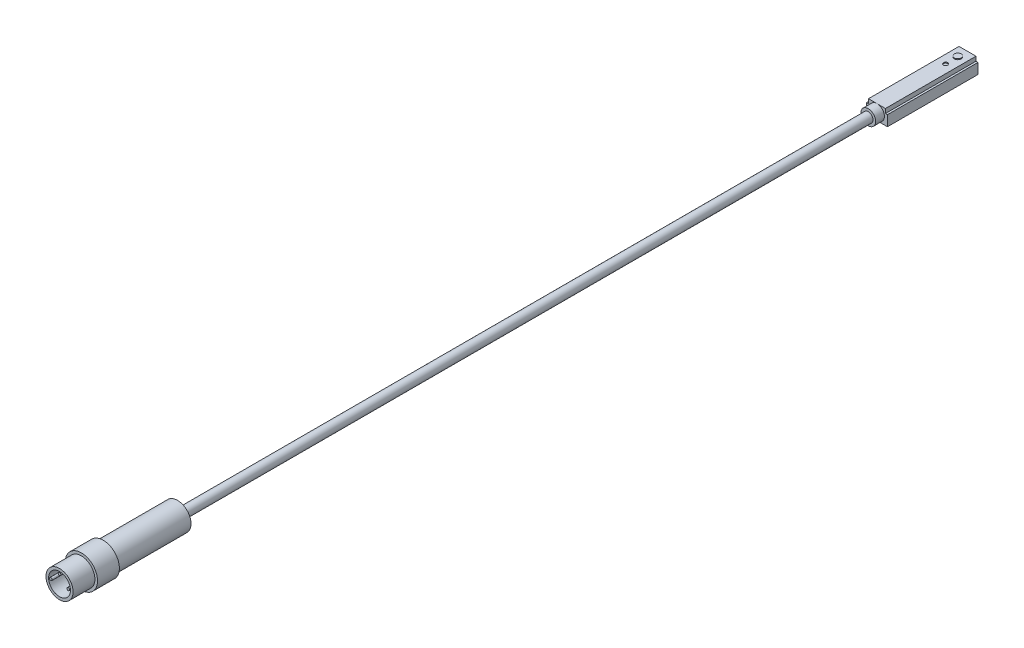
SolidWorks part; units mm, degrees
ref_plane "Front Plane" through (0, 0, 0) normal (0, 0, 1) x (1, 0, 0)
ref_plane "Top Plane" through (0, 0, 0) normal (0, 1, 0) x (1, 0, 0)
ref_plane "Right Plane" through (0, 0, 0) normal (1, 0, 0) x (0, 0, -1)
sketch "S2D0001" plane through (0, 0, 0) normal (0, 0, 1) x (1, 0, 0)
  line L0 (-3.048, 0) -> (-3.048, 3.048)
  line L1 (-2.4638, 4.318) -> (2.4638, 4.318)
  line L2 (3.048, 3.048) -> (3.048, 0)
  line L3 (3.048, 0) -> (-3.048, 0)
  line L4 (2.4638, 4.318) -> (2.4638, 3.048)
  line L5 (2.4638, 3.048) -> (3.048, 3.048)
  line L6 (-2.4638, 4.318) -> (-2.4638, 3.048)
  line L7 (-2.4638, 3.048) -> (-3.048, 3.048)
  line L8 (0, 0) -> (0, 4.5339) construction
  dimension "D1" = 4.318
  dimension "D2" = 6.096
  dimension "D3" = 4.9276
  dimension "D4" = 1.27
extrude "Extrude1" add sketch "S2D0001" along normal blind 28.8544
sketch "Sketch2" plane through (0, 0, 28.8544) normal (0, 0, 1) x (1, 0, 0)
  line L0 (-3.048, 0) -> (3.048, 0) construction
  circle A0 centre (0, 2.159) radius 2.159
  dimension "D1" = 4.318
  dimension "D2" = 2.159
extrude "Cut-Extrude1" cut sketch "Sketch2" against normal blind 2.54 flip side to cut
ref_plane "Plane2" through (0, 0, 0) normal (1, 0, 0) x (0, 1, 0)
sketch "Sketch3" plane through (0, 0, 0) normal (1, 0, 0) x (0, 1, 0)
  line L0 (-0.508, 2.8224) -> (4.572, 2.8224)
  line L1 (4.572, 2.8224) -> (4.572, 3.8384)
  line L2 (4.572, 3.8384) -> (-0.508, 3.8384)
  line L3 (-0.508, 3.8384) -> (-0.508, 2.8224)
  line L4 (-0.762, 2.8224) -> (4.826, 2.8224) construction
  line L5 (0, 0) -> (3.048, 0) construction
  line L8 (0, 26.3144) -> (0, 0) construction
  line L9 (4.318, 26.3144) -> (4.318, 0) construction
  dimension "D1" = 2.8224
  dimension "D2" = 0.254
  dimension "D3" = 0.508
  dimension "D4" = 2.032
revolve "Revolve1" add sketch "Sketch3" angle 360 about L4
sketch "Sketch4" plane through (0, 0, 0) normal (0, 0, -1) x (-1, 0, 0)
  circle A0 centre (0, 2.159) radius 1.397
  circle A1 centre (0, 2.159) radius 2.159 construction
  dimension "D1" = 2.794
extrude "Extrude2" add sketch "Sketch4" against normal blind 263.906
ref_plane "Plane4" through (0, 0, 0) normal (1, 0, 0) x (0, 0, -1)
sketch "Sketch5" plane through (0, 0, 0) normal (1, 0, 0) x (0, 0, -1)
  line L0 (-263.906, 2.159) -> (-263.906, 6.096)
  line L1 (-263.906, 6.096) -> (-257.556, 6.096)
  line L2 (-257.556, 6.096) -> (-257.556, 6.858)
  line L3 (-257.556, 6.858) -> (-251.206, 6.858)
  line L4 (-251.206, 6.858) -> (-251.206, 6.096)
  line L5 (-251.206, 6.096) -> (-229.616, 6.096)
  line L6 (-229.616, 6.096) -> (-229.616, 2.159)
  line L7 (-229.616, 2.159) -> (-263.906, 2.159)
  line L8 (-265.6205, 2.159) -> (-227.9015, 2.159) construction
  line L9 (-263.906, 2.159) -> (-28.8544, 2.159) construction
  line L10 (-263.906, 3.556) -> (-263.906, 0.762) construction
  dimension "D1" = 7.874
  dimension "D2" = 34.29
  dimension "D3" = 6.35
  dimension "D4" = 6.35
  dimension "D5" = 9.398
revolve "Revolve2" add sketch "Sketch5" angle 360 about L8
sketch "Sketch6" plane through (0, 0, 263.906) normal (0, 0, 1) x (1, 0, 0)
  line L0 (-3.4925, 2.159) -> (3.4925, 2.159) construction
  circle A0 centre (0, 2.159) radius 3.175
  circle A1 centre (0, 4.699) radius 0.381
  circle A2 centre (2.54, 2.159) radius 0.381
  circle A3 centre (-2.54, 2.159) radius 0.381
  circle A4 centre (0, 2.159) radius 3.937 construction
  circle A5 centre (0, 2.159) radius 2.54 construction
  dimension "D1" = 6.35
  dimension "D2" = 5.08
  dimension "D3" = 0.762
extrude "Cut-Extrude2" cut sketch "Sketch6" against normal blind 5.08
sketch "Sketch7" plane through (0, 4.318, 0) normal (0, 1, 0) x (1, 0, 0)
  line L0 (2.4638, 0) -> (-2.4638, 0) construction
  circle A0 centre (0, -6.35) radius 0.635
  dimension "D1" = 1.27
  dimension "D2" = 6.35
extrude "Cut-Extrude3" cut sketch "Sketch7" against normal blind 0.254
